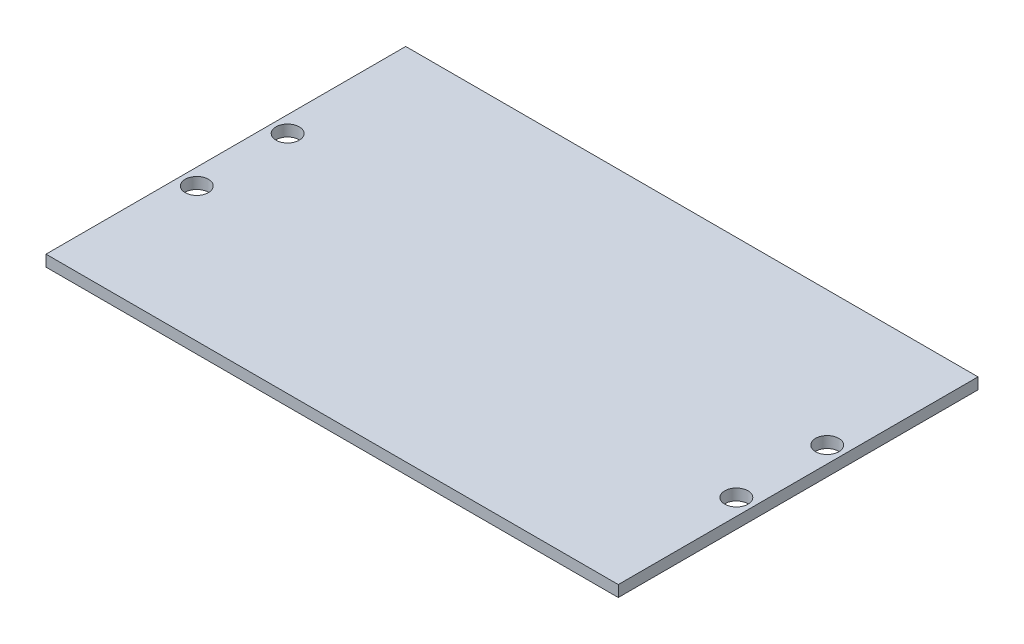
SolidWorks part; units mm, degrees
ref_plane "Front Plane" through (0, 0, 0) normal (0, 0, 1) x (1, 0, 0)
ref_plane "Top Plane" through (0, 0, 0) normal (0, 1, 0) x (1, 0, 0)
ref_plane "Right Plane" through (0, 0, 0) normal (1, 0, 0) x (0, 0, -1)
sketch "Sketch1" plane through (0, 0, 0) normal (0, 1, 0) x (1, 0, 0)
  line L1 (-40.005, -25.146) -> (40.005, -25.146)
  line L2 (-40.005, -25.146) -> (-40.005, 25.146)
  line L3 (-40.005, 25.146) -> (40.005, 25.146)
  line L4 (40.005, -25.146) -> (40.005, 25.146)
  line L5 (-40.005, -25.146) -> (40.005, 25.146) construction
  line L6 (-40.005, 25.146) -> (40.005, -25.146) construction
  point P0 (0, 0)
extrude "Boss-Extrude1" add sketch "Sketch1" along normal blind 1.5748
sketch "Sketch2" plane through (0, 1.5748, 0) normal (0, 1, 0) x (1, 0, 0)
  circle A0 centre (-37.719, 6.35) radius 1.6256
  circle A1 centre (-37.719, -6.35) radius 1.6256
  circle A2 centre (37.719, 6.35) radius 1.6256
  circle A3 centre (37.719, -6.35) radius 1.6256
extrude "Cut-Extrude1" cut sketch "Sketch2" against normal blind 1.5748
